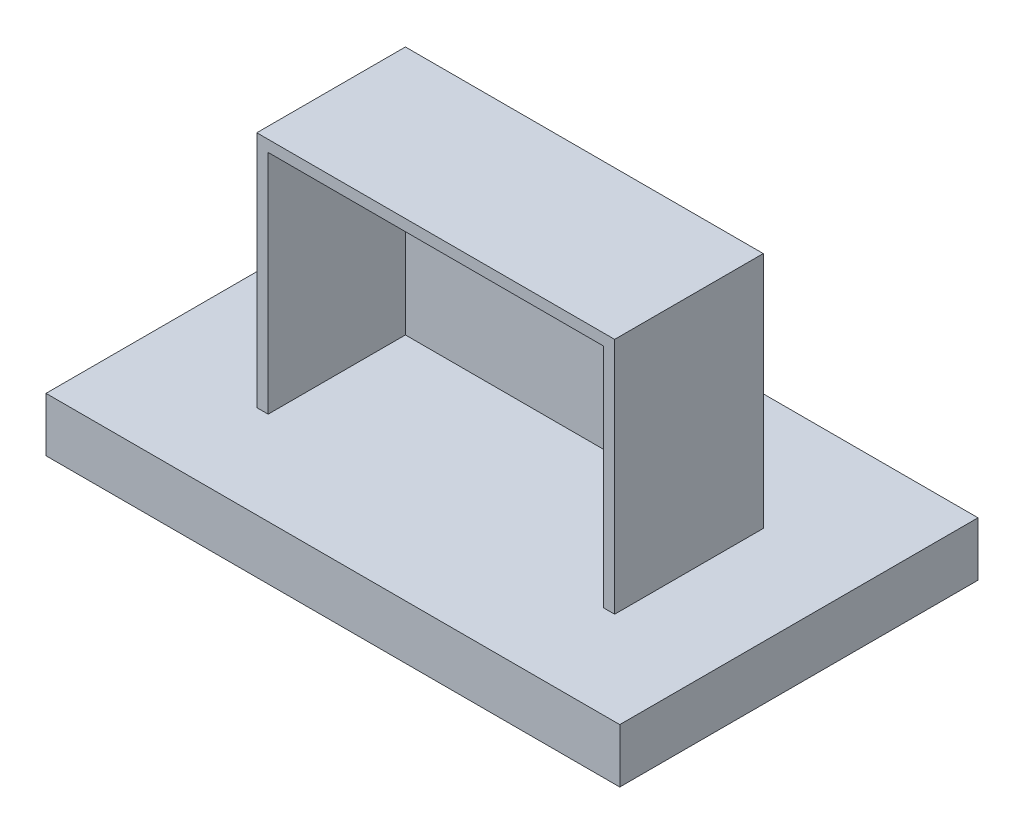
SolidWorks part; units mm, degrees
ref_plane "Front Plane" through (0, 0, 0) normal (0, 0, 1) x (1, 0, 0)
ref_plane "Top Plane" through (0, 0, 0) normal (0, 1, 0) x (1, 0, 0)
ref_plane "Right Plane" through (0, 0, 0) normal (1, 0, 0) x (0, 0, -1)
sketch "Sketch1" plane through (0, 0, 0) normal (0, 1, 0) x (1, 0, 0)
  line L1 (0, 0) -> (128.3272, 0)
  line L2 (0, 0) -> (0, 80.1223)
  line L3 (0, 80.1223) -> (128.3272, 80.1223)
  line L4 (128.3272, 0) -> (128.3272, 80.1223)
extrude "Extrude1" add sketch "Sketch1" along normal blind 12.0953
sketch "Sketch2" plane through (0, 12.0953, 0) normal (0, 1, 0) x (-1, 0, 0)
  line L1 (-26.3406, -54.0424) -> (-106.3796, -54.0424)
  line L2 (-26.3406, -54.0424) -> (-26.3406, -20.8057)
  line L3 (-26.3406, -20.8057) -> (-106.3796, -20.8057)
  line L4 (-106.3796, -54.0424) -> (-106.3796, -20.8057)
extrude "Extrude2" add sketch "Sketch2" along normal blind 53.2433 separate body
shell "Shell1" thickness 2.54
